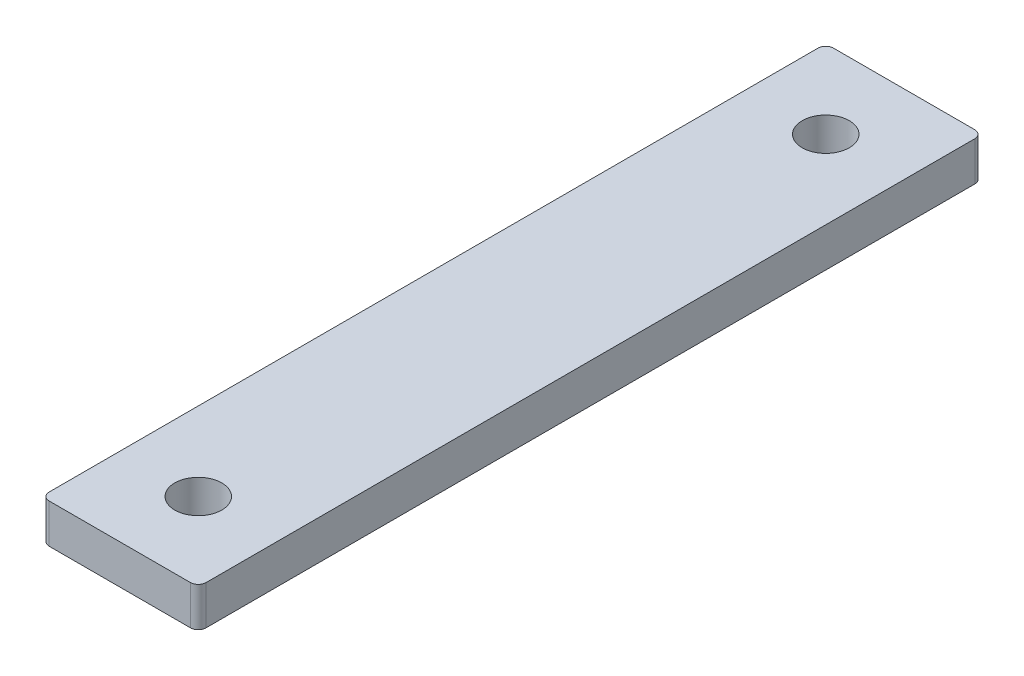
SolidWorks part; units mm, degrees
ref_plane "Front Plane" through (0, 0, 0) normal (0, 0, 1) x (1, 0, 0)
ref_plane "Top Plane" through (0, 0, 0) normal (0, 1, 0) x (1, 0, 0)
ref_plane "Right Plane" through (0, 0, 0) normal (1, 0, 0) x (0, 0, -1)
sketch "Sketch1" plane through (0, 0, 0) normal (0, 1, 0) x (1, 0, 0)
  line L1 (0, 0) -> (20, 0)
  line L2 (0, 0) -> (0, 100)
  line L3 (0, 100) -> (20, 100)
  line L4 (20, 0) -> (20, 100)
  circle A0 centre (10, 10) radius 3
  circle A1 centre (10, 90) radius 3
  dimension "D1" = 6
  dimension "D2" = 10
  dimension "D3" = 10
  dimension "D4" = 10
  dimension "D5" = 6
  dimension "D6" = 10
  dimension "D7" = 10
  dimension "D8" = 80
extrude "Boss-Extrude1" add sketch "Sketch1" along normal blind 5
fillet "Fillet1" radius 1 4 edges at (0, 2.5, -100) (20, 2.5, -100) (0, 2.5, 0) (20, 2.5, 0)
